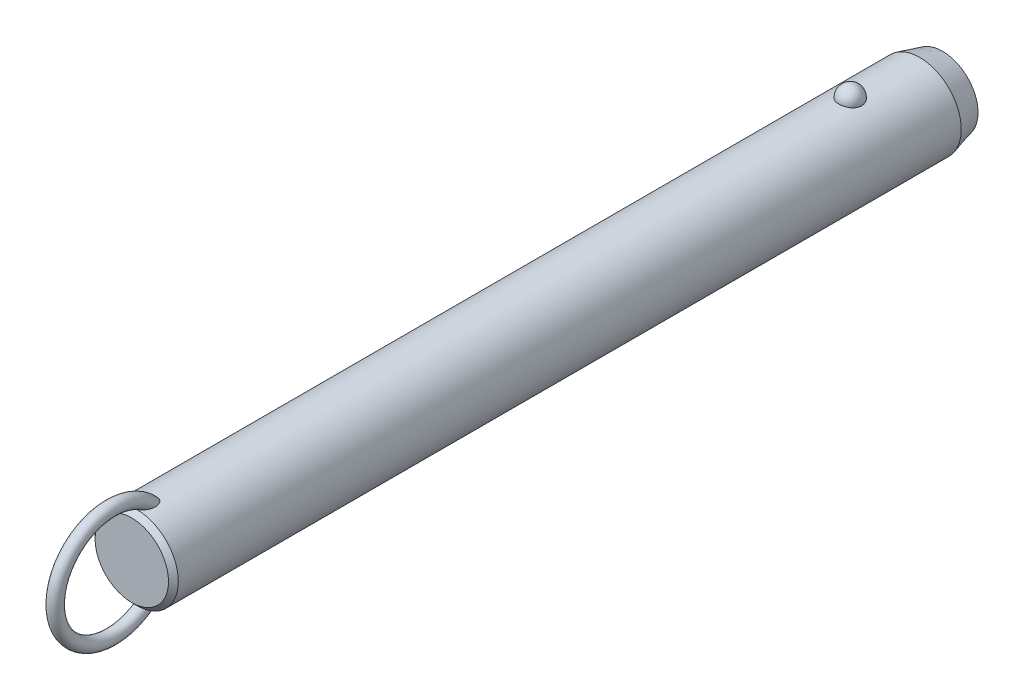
SolidWorks part; units mm, degrees
ref_plane "Front Plane" through (0, 0, 0) normal (0, 0, 1) x (1, 0, 0)
ref_plane "Top Plane" through (0, 0, 0) normal (0, 1, 0) x (1, 0, 0)
ref_plane "Right Plane" through (0, 0, 0) normal (1, 0, 0) x (0, 0, -1)
sketch "Sketch2" plane through (0, 0, 0) normal (0, 0, 1) x (1, 0, 0)
  circle A0 centre (0, 0) radius 12.7
  point P3 (0, 12.7)
  dimension "D1" = 25.4
extrude "Boss-Extrude1" add sketch "Sketch2" along normal blind 203.2
sketch "Sketch3" plane through (0, 0, 0) normal (0, 0, -1) x (-1, 0, 0)
  circle A0 centre (0, 0) radius 12.7
  dimension "D1" = 25.4
extrude "Boss-Extrude2" add sketch "Sketch3" along normal blind 31.7
chamfer "Chamfer1" distance 7 angle 15 1 edges at (-12.7, 0, -31.7)
sketch "Sketch12" plane through (0, 0, 0) normal (1, 0, 0) x (0, 0, -1)
  line L0 (-203.2, 12.7) -> (-203.2, -12.7) construction
  point P0 (-203.2, 0)
sketch "Sketch13" plane through (0, 0, 0) normal (1, 0, 0) x (0, 0, -1)
  circle A0 centre (-222.25, 0) radius 19.05
  point P2 (-203.2, 0)
  dimension "D1" = 38.1
sketch "Sketch14" plane through (0, 0, 0) normal (0, 1, 0) x (1, 0, 0)
  circle A0 centre (0, -205.2) radius 2
  point P2 (0, -203.2)
  dimension "D1" = 4
sweep "Sweep1" add profiles "Sketch14" path "Sketch13"
sketch "Sketch15" plane through (0, 0, 203.2) normal (0, 0, 1) x (1, 0, 0)
  circle A0 centre (0, 0) radius 12.7
  dimension "D1" = 25.4
extrude "Boss-Extrude3" add sketch "Sketch15" along normal blind 12.7
chamfer "Chamfer2" distance 1.5 angle 45 1 edges at (12.7, 0, 215.9)
sketch "Sketch18" plane through (0, 0, 0) normal (1, 0, 0) x (0, 0, -1)
  line L0 (24.7, 12.7) -> (-208.051, 12.7) construction
  line L1 (3.5, 16.2) -> (3.5, 9.2)
  line L2 (-208.051, -12.7) -> (24.7, -12.7) construction
  arc A0 (3.5, 16.2) -> (3.5, 9.2) centre (3.5, 12.7) ccw
  point P4 (0, 12.7)
  dimension "D1" = 28.9
revolve "Revolve1" add sketch "Sketch18" angle 360 about L1
